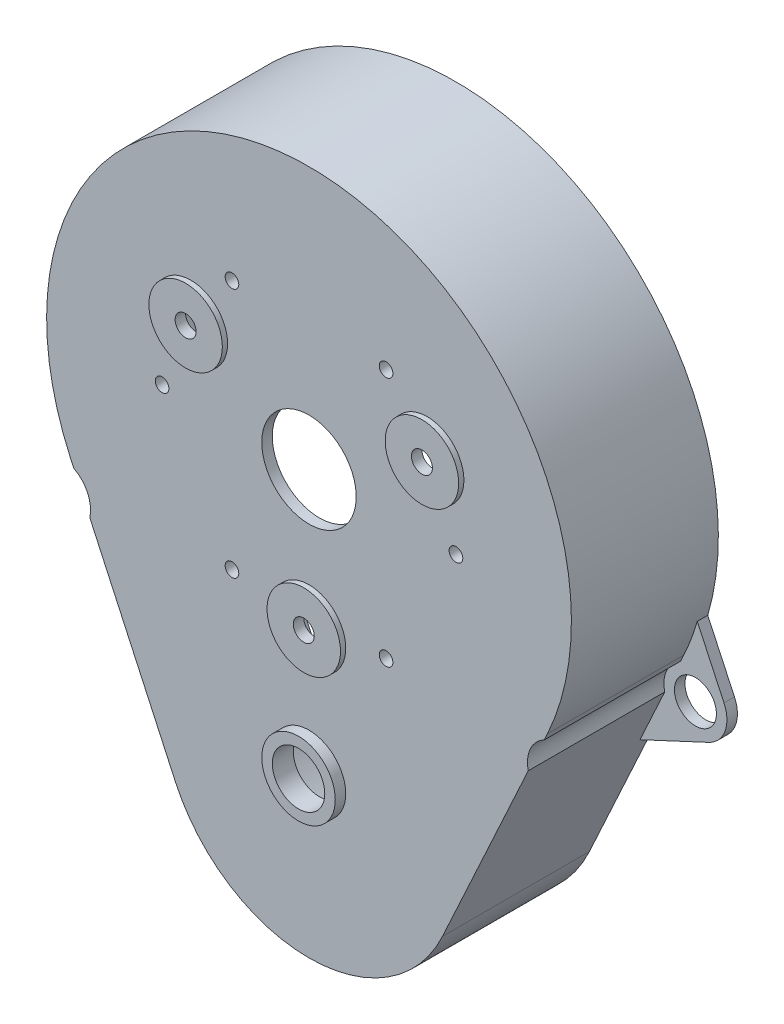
SolidWorks part; units mm, degrees
ref_plane "FACE" through (0, 0, 0) normal (0, 0, 1) x (1, 0, 0)
ref_plane "DESSUS" through (0, 0, 0) normal (0, 1, 0) x (1, 0, 0)
ref_plane "GAUCHE" through (0, 0, 0) normal (1, 0, 0) x (0, 0, -1)
sketch "Esquisse1" plane through (0, 0, 0) normal (0, 0, 1) x (1, 0, 0)
  line L0 (12.7166, -32.1555) -> (18.5332, -19.5234) construction
  line L1 (-18.5332, -19.5234) -> (-12.7166, -32.1555) construction
  line L2 (12.7166, -32.1555) -> (22.7083, -10.4563)
  line L3 (-22.7083, -10.4563) -> (-12.7166, -32.1555)
  arc A0 (-12.7166, -32.1555) -> (12.7166, -32.1555) centre (0, -26.3) ccw construction
  arc A1 (23.9916, -7.0287) -> (-23.9916, -7.0287) centre (0, 0) ccw construction
  arc A2 (-12.7166, -32.1555) -> (12.7166, -32.1555) centre (0, -26.3) ccw
  arc A3 (22.7083, -10.4563) -> (-22.7083, -10.4563) centre (0, 0) ccw
extrude "Base-Extrusion" add sketch "Esquisse1" along normal blind 14
shell "Coque1" thickness 1
sketch "Esquisse2" plane through (0, 0, 0) normal (0, 0, -1) x (-1, 0, 0)
  line L0 (25.124, -9.4571) -> (26.5346, -12.4821) construction
  line L1 (25.0836, -16.4689) -> (20.3157, -18.6922) construction
  line L2 (-25.0836, -16.4689) -> (-20.3157, -18.6922) construction
  line L3 (-25.124, -9.4571) -> (-26.5346, -12.4821) construction
  line L4 (23.9916, -7.0287) -> (26.5346, -12.4821)
  line L5 (25.0836, -16.4689) -> (18.5332, -19.5234)
  line L6 (-25.0836, -16.4689) -> (-18.5332, -19.5234)
  line L7 (-23.9916, -7.0287) -> (-26.5346, -12.4821)
  line L8 (-12.7166, -32.1555) -> (-22.7083, -10.4563) construction
  line L9 (22.7083, -10.4563) -> (12.7166, -32.1555) construction
  line L10 (-18.5332, -19.5234) -> (-22.7083, -10.4563)
  line L11 (22.7083, -10.4563) -> (18.5332, -19.5234)
  arc A0 (25.0836, -16.4689) -> (26.5346, -12.4821) centre (23.8157, -13.75) ccw construction
  arc A1 (-26.5346, -12.4821) -> (-25.0836, -16.4689) centre (-23.8157, -13.75) ccw construction
  arc A2 (25.0836, -16.4689) -> (26.5346, -12.4821) centre (23.8157, -13.75) ccw
  arc A3 (-26.5346, -12.4821) -> (-25.0836, -16.4689) centre (-23.8157, -13.75) ccw
  arc A4 (22.7083, -10.4563) -> (-22.7083, -10.4563) centre (0, 0) ccw construction
  arc A5 (22.7083, -10.4563) -> (23.9916, -7.0287) centre (0, 0) ccw
  arc A6 (-23.9916, -7.0287) -> (-22.7083, -10.4563) centre (0, 0) ccw
  circle A7 centre (23.8157, -13.75) radius 2 construction
  circle A8 centre (-23.8157, -13.75) radius 2 construction
  circle A9 centre (23.8157, -13.75) radius 2
  circle A10 centre (-23.8157, -13.75) radius 2
extrude "Boss.-Extru.1" add sketch "Esquisse2" against normal blind 1
sketch "Esquisse3" plane through (0, 0, 1) normal (0, 0, 1) x (1, 0, 0)
  line L0 (12.7166, -32.1555) -> (22.7083, -10.4563) construction
  line L1 (20.8887, -14.4079) -> (22.4127, -11.0983)
  arc A0 (25.0836, -16.4689) -> (26.5346, -12.4821) centre (23.8157, -13.75) ccw construction
  arc A1 (22.4127, -11.0983) -> (20.8887, -14.4079) centre (23.8157, -13.75) ccw
extrude "Enlèv. mat.-Extru.1" cut sketch "Esquisse3" along normal through all
sketch "Esquisse4" plane through (0, 0, 1) normal (0, 0, 1) x (1, 0, 0)
  line L0 (-22.7083, -10.4563) -> (-12.7166, -32.1555) construction
  line L1 (-22.4127, -11.0983) -> (-20.8887, -14.4079)
  arc A0 (-26.5346, -12.4821) -> (-25.0836, -16.4689) centre (-23.8157, -13.75) ccw construction
  arc A1 (-20.8887, -14.4079) -> (-22.4127, -11.0983) centre (-23.8157, -13.75) ccw
extrude "Enlèv. mat.-Extru.2" cut sketch "Esquisse4" along normal through all
sketch "Esquisse5" plane through (0, 0, 13) normal (0, 0, -1) x (-1, 0, 0)
  circle A0 centre (7.3426, 11.92) radius 0.65 construction
  circle A1 centre (14, 0) radius 0.65 construction
  circle A2 centre (7.3426, -11.92) radius 0.65 construction
  circle A3 centre (-7.3426, -11.92) radius 0.65 construction
  circle A4 centre (-14, 0) radius 0.65 construction
  circle A5 centre (-7.3426, 11.92) radius 0.65 construction
  circle A6 centre (7.3426, 11.92) radius 0.65
  circle A7 centre (14, 0) radius 0.65
  circle A8 centre (7.3426, -11.92) radius 0.65
  circle A9 centre (-7.3426, -11.92) radius 0.65
  circle A10 centre (-14, 0) radius 0.65
  circle A11 centre (-7.3426, 11.92) radius 0.65
extrude "Enlèv. mat.-Extru.3" cut sketch "Esquisse5" against normal through all
sketch "Esquisse6" plane through (0, 0, 13) normal (0, 0, -1) x (-1, 0, 0)
  circle A0 centre (0, -25) radius 2.5
  circle A1 centre (0, -25) radius 9.65 construction
  dimension "D1" = 5
extrude "Enlèv. mat.-Extru.4" cut sketch "Esquisse6" against normal through all
sketch "Esquisse7" plane through (0, 0, 13) normal (0, 0, -1) x (-1, 0, 0)
  circle A0 centre (0, 0) radius 4.5
  dimension "D1" = 9
extrude "Enlèv. mat.-Extru.5" cut sketch "Esquisse7" against normal through all
sketch "Esquisse8" plane through (0, 0, 13) normal (0, 0, -1) x (-1, 0, 0)
  line L0 (0, 0) -> (0, -42) construction
  line L1 (0, 0) -> (18.412, 10.6301) construction
  circle A0 centre (11.2583, 6.5) radius 3.5
  dimension "D2" = 7
  dimension "D1" = 120
  dimension "D3" = 13
extrude "Enlèv. mat.-Extru.6" cut sketch "Esquisse8" against normal blind 0.5
pattern_circular "Répétition circulaire1" count 3 every 120
sketch "Esquisse9" plane through (0, 0, 14) normal (0, 0, 1) x (1, 0, 0)
  circle A0 centre (0, -13) radius 3.5 construction
  circle A1 centre (-11.2583, 6.5) radius 3.5 construction
  circle A2 centre (11.2583, 6.5) radius 3.5 construction
  circle A3 centre (0, -13) radius 3.5
  circle A4 centre (-11.2583, 6.5) radius 3.5
  circle A5 centre (11.2583, 6.5) radius 3.5
extrude "Boss.-Extru.2" add sketch "Esquisse9" along normal blind 0.5
sketch "Esquisse10" plane through (0, 0, 14) normal (0, 0, 1) x (1, 0, 0)
  circle A0 centre (0, -25) radius 3.5
  circle A1 centre (0, -25) radius 2.5 construction
  circle A2 centre (0, -25) radius 2.5
  dimension "D1" = 7
extrude "Boss.-Extru.3" add sketch "Esquisse10" along normal blind 1
sketch "Esquisse11" plane through (0, 0, 13.5) normal (0, 0, -1) x (-1, 0, 0)
  circle A0 centre (11.2583, 6.5) radius 1
  circle A1 centre (11.2583, 6.5) radius 3.5 construction
  dimension "D1" = 2
extrude "Enlèv. mat.-Extru.7" cut sketch "Esquisse11" against normal through all
pattern_circular "Répétition circulaire2" count 3 every 120
